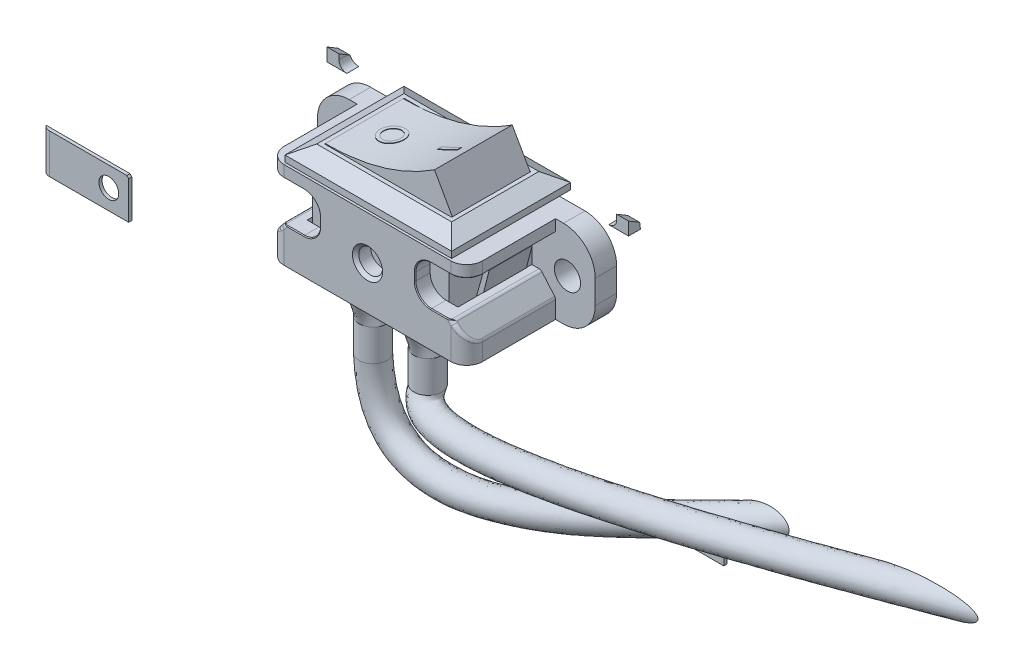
SolidWorks part; units mm, degrees
ref_plane "前视基准面" through (0, 0, 0) normal (0, 0, 1) x (1, 0, 0)
ref_plane "上视基准面" through (0, 0, 0) normal (0, 1, 0) x (1, 0, 0)
ref_plane "右视基准面" through (0, 0, 0) normal (1, 0, 0) x (0, 0, -1)
imported_body "开关组件-1/开关座-1-solid1"
imported_body "开关组件-1/开关-1-solid1"
imported_body "中心板电源插座V2V4-V5-CV7-1/复件 复件 装配体1^中心板电源插座V2V4-V5-CV7-1/I2C PIN脚V2V4-V5-C-V6-1-solid1"
imported_body "中心板电源插座V2V4-V5-CV7-1/复件 复件 装配体1^中心板电源插座V2V4-V5-CV7-1/I2C PIN脚V2V4-V5-C-V6-2-solid1"
imported_body "中心板电源插座V2V4-V5-CV7-1/复件 复件 装配体1^中心板电源插座V2V4-V5-CV7-1/WM610_插座铜片V2V4-V5-C-V6-1-solid1"
imported_body "中心板电源插座V2V4-V5-CV7-1/复件 复件 装配体1^中心板电源插座V2V4-V5-CV7-1/I2C PIN脚V2V4-V5-C-V6-3-solid1"
imported_body "中心板电源插座V2V4-V5-CV7-1/复件 复件 装配体1^中心板电源插座V2V4-V5-CV7-1/I2C PIN脚V2V4-V5-C-V6-4-solid1"
imported_body "中心板电源插座V2V4-V5-CV7-1/复件 复件 装配体1^中心板电源插座V2V4-V5-CV7-1/WM610_插座铜片（正极）V2V4-V5-C-V6-1-solid1"
imported_body "中心板电源插座V2V4-V5-CV7-1/复件 复件 装配体1^中心板电源插座V2V4-V5-CV7-1/wm610_cb_v7-C-V6-1-solid1"
imported_body "中心板电源插座V2V4-V5-CV7-1/复件 复件 装配体1^中心板电源插座V2V4-V5-CV7-1/电源插座V2V4-V5-V6-1-solid1"
imported_body "电池架V3-1-solid1"
imported_body "电池架绝缘片-1-solid1"
imported_body "电池架绝缘片-1-solid2"
imported_body "电池架绝缘片-1-solid3"
imported_body "jst插头-1-solid1"
sketch "草图1" plane through (66.5, 0, 0) normal (1, 0, 0) x (0, 0, -1)
  line L0 (-27.7, 3) -> (-26.2, 3)
  line L1 (-24.7, 3) -> (-27.7, 3) construction
  line L2 (-26.2, 3) -> (-26.3, 3.8)
  line L3 (-26.3, 3.8) -> (-28.3, 5)
  line L4 (-28.3, 5) -> (-28.3, 12.0302)
  line L5 (-28.3, 12.0302) -> (-43.7459, 12.0302)
  line L6 (-43.7459, 12.0302) -> (-43.7459, -31.6066)
  line L7 (-43.7459, -31.6066) -> (-27.3, -31.6066)
  line L8 (-27.3, -31.6066) -> (-27.3, -8.5)
  line L9 (-27.7, -8.5) -> (-26.5, -8.5) construction
  line L10 (-27.3, -8.5) -> (-27.7, -8.5)
  line L11 (-27.7, -8.5) -> (-27.7, 3)
  line L13 (-66.6769, 28.5723) -> (43.282, 28.5723)
  line L14 (-66.6769, 28.5723) -> (-66.6769, -53.9697)
  line L15 (-66.6769, -53.9697) -> (43.282, -53.9697)
  line L16 (43.282, 28.5723) -> (43.282, -53.9697)
extrude "切除-拉伸1" cut sketch "草图1" against normal mid plane 222
